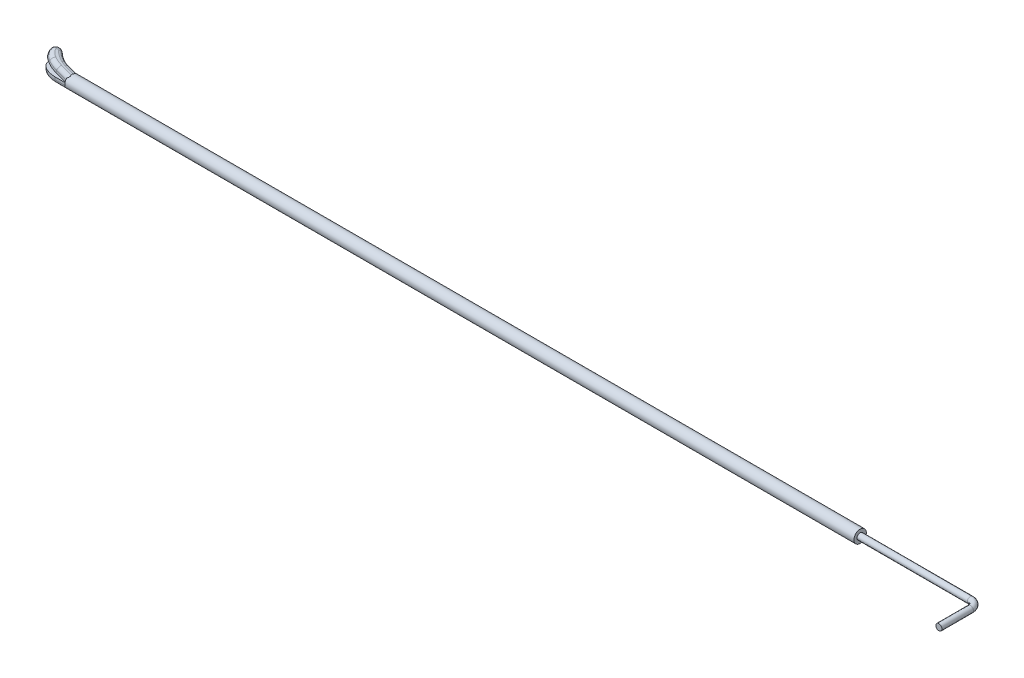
SolidWorks part; units mm, degrees
ref_plane "Front Plane" through (0, 0, 0) normal (0, 0, 1) x (1, 0, 0)
ref_plane "Top Plane" through (0, 0, 0) normal (0, 1, 0) x (1, 0, 0)
ref_plane "Right Plane" through (0, 0, 0) normal (1, 0, 0) x (0, 0, -1)
imported_body "Imported3"
sketch "Sketch1" plane through (-29.7502, 0, 0) normal (1, 0, 0) x (0, 0, -1)
  circle A0 centre (0, 0) radius 1
extrude "Boss-Extrude1" add sketch "Sketch1" along normal blind 127
sketch "Sketch2" plane through (97.2498, 0, 0) normal (1, 0, 0) x (0, 0, -1)
  circle A0 centre (0, 0) radius 0.5
extrude "Boss-Extrude2" add sketch "Sketch2" along normal blind 17.78
scale "Scale1" bodies to scale 106 scale about centroid uniform scaling yes scale factor 2
scale "Scale2" scale about centroid uniform scaling yes scale factor 1
scale "Scale3" scale about centroid uniform scaling yes scale factor 0.5
sketch "Sketch3" plane through (115.0006, 0, 0) normal (1, 0, 0) x (0, 0, -1)
  circle A0 centre (0.0008, 0.0007) radius 0.5
sketch "Sketch4" plane through (0, 0, 0) normal (0, 1, 0) x (1, 0, 0)
  line L1 (115.0006, -0.4992) -> (115.0006, 0.5008) construction
  line L2 (116.2706, -1.2692) -> (116.2706, -6.3492)
  arc A0 (116.2706, -1.2692) -> (115.0006, 0.0008) centre (115.0006, -1.2692) ccw
sweep "Sweep1" add profiles "Sketch3" path "Sketch4"
